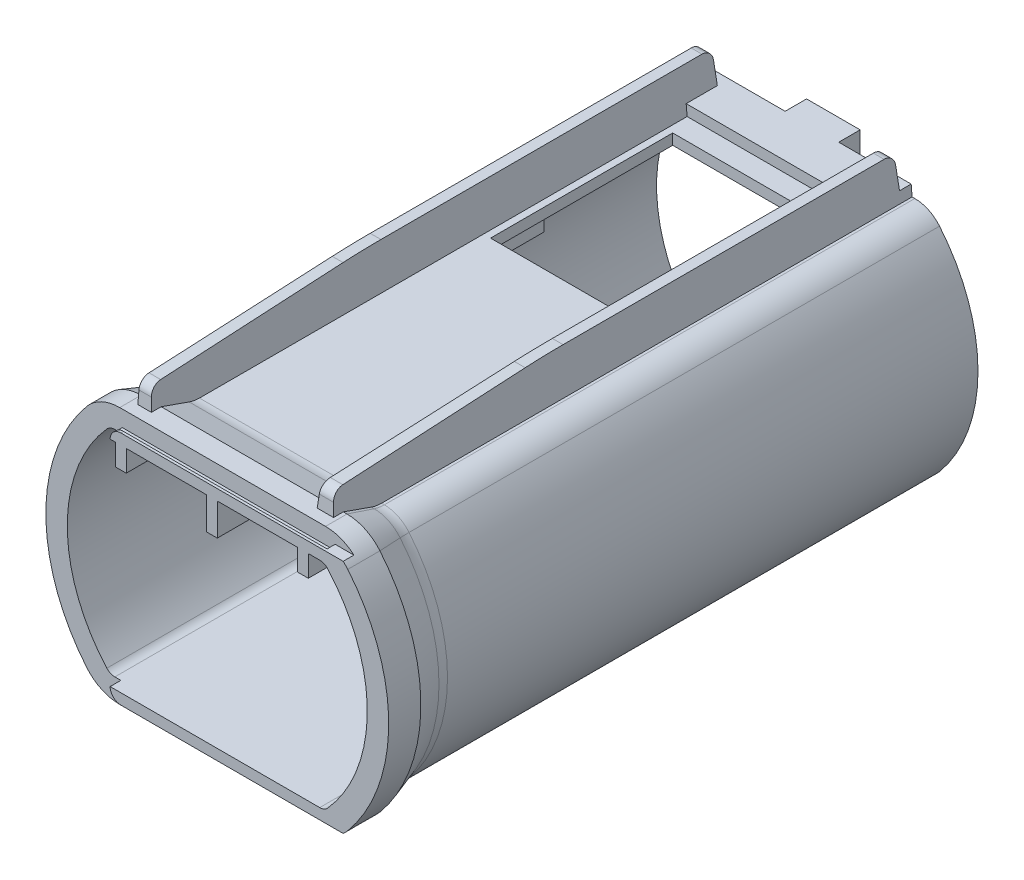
SolidWorks part; units mm, degrees
ref_plane "Front Plane" through (0, 0, 0) normal (0, 0, 1) x (1, 0, 0)
ref_plane "Top Plane" through (0, 0, 0) normal (0, 1, 0) x (1, 0, 0)
ref_plane "Right Plane" through (0, 0, 0) normal (1, 0, 0) x (0, 0, -1)
sketch "Sketch1" plane through (0, 0, 0) normal (0, 0, 1) x (1, 0, 0)
  line L0 (0, -10) -> (0, 10) construction
  line L1 (-10.5, 10) -> (10.5, 10)
  line L2 (14.5, 0) -> (14.5, 10) construction
  line L3 (-10.5, -10) -> (10.5, -10)
  line L4 (10.5, 10) -> (10.5, -10) construction
  line L5 (-14.5, 0) -> (-14.5, 15.1719) construction
  arc A0 (10.5, -10) -> (10.5, 10) centre (0, 0) ccw
  arc A1 (-10.5, 10) -> (-10.5, -10) centre (0, 0) ccw
  point P8 (0, 0)
  dimension "D1" = 29
  dimension "D2" = 20
extrude "Extrude-Thin2" add sketch "Sketch1" along normal blind 53 thin
fillet "Fillet3" radius 1 4 edges at (-10.5, -10, 26.5) (10.5, -10, 26.5) (10.5, 10, 26.5) (-10.5, 10, 26.5)
fillet "Fillet4" radius 3 4 edges at (-10.9202, 11, 26.5) (10.9202, 11, 26.5) (10.9202, -11, 26.5) (-10.9202, -11, 26.5)
ref_plane "Plane2" through (0, 0, 56) normal (0, 0, 1) x (1, 0, 0)
sketch "Sketch27" plane through (0, 0, 53) normal (0, 0, 1) x (1, 0, 0)
  circle A0 centre (0, 0) radius 21.9056
extrude "Extrude13" add sketch "Sketch27" along normal blind 2
chamfer "Chamfer1" distance 3 distance2 1 8 edges at (0, -11, 53) (10.8775, -10.7166, 53) (-10.8775, -10.7166, 53) (15.5, 0, 53) (-15.5, 0, 53) (10.8775, 10.7166, 53) (-10.8775, 10.7166, 53) (0, 11, 53)
ref_plane "Plane4" through (0, 0, 53) normal (0, 0, -1) x (-1, 0, 0)
other "SurfaceCut1"
fillet "Fillet6" radius 3 8 edges at (-10.8775, 10.7166, 50) (-10.8775, -10.7166, 50) (0, -11, 50) (10.8775, -10.7166, 50) (15.5, 0, 50) (10.8775, 10.7166, 50) (0, 11, 50) (-15.5, 0, 50)
sketch "Sketch8" plane through (0, 11, 0) normal (0, 1, 0) x (-1, 0, 0)
  line L1 (9, 0) -> (-9, 0)
  line L2 (9, 0) -> (9, 4)
  line L3 (9, 4) -> (-9, 4)
  line L4 (-9, 0) -> (-9, 4)
  line L5 (-9.6047, 0) -> (9.6047, 0) construction
  point P6 (0, 4)
  dimension "D1" = 18
  dimension "D2" = 4
extrude "Extrude7" add sketch "Sketch8" along normal blind 1
sketch "Sketch28" plane through (0, 0, 53) normal (0, 0, 1) x (1, 0, 0)
  line L0 (10.0623, 10) -> (-10.0623, 10) construction
  line L1 (-10.0623, -10) -> (10.0623, -10) construction
  line L2 (9.6047, 12) -> (-9.6047, 12)
  line L3 (9.6047, 12) -> (-9.6047, 12)
  line L4 (-9.6047, -12) -> (9.6047, -12)
  line L5 (-9.6047, -12) -> (9.6047, -12)
  line L6 (10.0623, 10) -> (-10.0623, 10)
  line L7 (-10.0623, -10) -> (10.0623, -10)
  arc A0 (10.0623, -10) -> (10.8077, -9.6667) centre (10.0623, -9) ccw construction
  arc A1 (10.8077, -9.6667) -> (10.8077, 9.6667) centre (0, 0) ccw construction
  arc A2 (10.8077, 9.6667) -> (10.0623, 10) centre (10.0623, 9) ccw construction
  arc A3 (-10.0623, 10) -> (-10.8077, 9.6667) centre (-10.0623, 9) ccw construction
  arc A4 (-10.8077, 9.6667) -> (-10.8077, -9.6667) centre (0, 0) ccw construction
  arc A5 (-10.8077, -9.6667) -> (-10.0623, -10) centre (-10.0623, -9) ccw construction
  arc A6 (10.0623, -10) -> (10.8077, -9.6667) centre (10.0623, -9) ccw
  arc A7 (10.8077, -9.6667) -> (10.8077, 9.6667) centre (0, 0) ccw
  arc A8 (12.6782, 10.56) -> (9.6047, 12) centre (9.6047, 8) ccw
  arc A9 (12.6782, 10.56) -> (9.6047, 12) centre (9.6047, 8) ccw
  arc A10 (-9.6047, 12) -> (-12.6782, 10.56) centre (-9.6047, 8) ccw
  arc A11 (-9.6047, 12) -> (-12.6782, 10.56) centre (-9.6047, 8) ccw
  arc A12 (-12.6782, -10.56) -> (-9.6047, -12) centre (-9.6047, -8) ccw
  arc A13 (-12.6782, -10.56) -> (-9.6047, -12) centre (-9.6047, -8) ccw
  arc A14 (-12.6782, 10.56) -> (-12.6782, -10.56) centre (0, 0) ccw
  arc A15 (-12.6782, 10.56) -> (-12.6782, -10.56) centre (0, 0) ccw
  arc A16 (9.6047, -12) -> (12.6782, -10.56) centre (9.6047, -8) ccw
  arc A17 (9.6047, -12) -> (12.6782, -10.56) centre (9.6047, -8) ccw
  arc A18 (12.6782, -10.56) -> (12.6782, 10.56) centre (0, 0) ccw
  arc A19 (12.6782, -10.56) -> (12.6782, 10.56) centre (0, 0) ccw
  arc A24 (10.8077, 9.6667) -> (10.0623, 10) centre (10.0623, 9) ccw
  arc A25 (-10.0623, 10) -> (-10.8077, 9.6667) centre (-10.0623, 9) ccw
  arc A26 (-10.8077, 9.6667) -> (-10.8077, -9.6667) centre (0, 0) ccw
  arc A27 (-10.8077, -9.6667) -> (-10.0623, -10) centre (-10.0623, -9) ccw
  dimension "D1" = 0
extrude "Extrude14" add sketch "Sketch28" along normal blind 3
sketch "Sketch9" plane through (9, 0, 0) normal (1, 0, 0) x (0, 0, -1)
  line L0 (-1, 11) -> (-1.35, 15)
  line L2 (-54, 11) -> (-53.7375, 14)
  line L3 (-53.7375, 14) -> (-35.7699, 14.9103)
  line L4 (-32.2279, 15) -> (-1.35, 15)
  line L5 (-54, 11) -> (-1, 11)
  line L6 (-1, 11) -> (-1, 22.6172) construction
  line L7 (-54, 11) -> (-54, 21.6834) construction
  arc A0 (-35.7699, 14.9103) -> (-32.2279, 15) centre (-32.2279, -55) cw
  point P15 (-34, 15)
  dimension "D8" = 70
  dimension "D1" = 5
  dimension "D2" = 5
  dimension "D3" = 4
  dimension "D7" = 3
extrude "Extrude8" add sketch "Sketch9" against normal blind 1
draft "Draft1" type of draft neutral plane draft angle 5 faces to draft 2 parameters "D1"=5
fillet "Fillet5" radius 1 2 edges at (8.5, 15, 1.35) (8.5, 14, 53.7375)
mirror "Mirror2" about plane through (0, 0, 0) normal (1, 0, 0) of "Fillet5", "Draft1", "Extrude8"
sketch "Sketch14" plane through (0, 0, 56) normal (0, 0, 1) x (1, 0, 0)
  line L12 (9.6047, 12) -> (-9.6047, 12) construction
  line L13 (-9.6047, -12) -> (9.6047, -12) construction
  line L16 (9.6047, 12) -> (-9.6047, 12)
  line L19 (-9.6047, -12) -> (9.6047, -12)
  line L20 (10.0623, 11) -> (-10.0623, 11)
  line L21 (12.2504, 11) -> (-8.5, 11)
  line L22 (-10.0623, 10) -> (-9.5, 10)
  line L23 (-10.0623, -11) -> (10.0623, -11)
  line L24 (-8.5, -11) -> (12.2504, -11)
  line L25 (10.0623, 10) -> (-10.0623, 10) construction
  line L26 (-10.0623, -10) -> (-9.5, -10)
  line L27 (-10.0623, -10) -> (10.0623, -10) construction
  line L28 (-9.5, -10) -> (-9.5, 10) construction
  arc A12 (-10.8077, -9.6667) -> (-10.0623, -10) centre (-10.0623, -9) ccw construction
  arc A13 (-10.8077, 9.6667) -> (-10.8077, -9.6667) centre (0, 0) ccw construction
  arc A14 (-10.0623, 10) -> (-10.8077, 9.6667) centre (-10.0623, 9) ccw construction
  arc A18 (12.6782, 10.56) -> (9.6047, 12) centre (9.6047, 8) ccw construction
  arc A19 (-9.6047, 12) -> (-12.6782, 10.56) centre (-9.6047, 8) ccw construction
  arc A20 (-12.6782, 10.56) -> (-12.6782, -10.56) centre (0, 0) ccw construction
  arc A21 (-12.6782, -10.56) -> (-9.6047, -12) centre (-9.6047, -8) ccw construction
  arc A22 (9.6047, -12) -> (12.6782, -10.56) centre (9.6047, -8) ccw construction
  arc A25 (-10.8077, -9.6667) -> (-10.0623, -10) centre (-10.0623, -9) ccw
  arc A26 (-10.8077, 9.6667) -> (-10.8077, -9.6667) centre (0, 0) ccw
  arc A27 (-10.0623, 10) -> (-10.8077, 9.6667) centre (-10.0623, 9) ccw
  arc A28 (12.2504, 11) -> (9.6047, 12) centre (9.6047, 8) ccw
  arc A29 (-9.6047, 12) -> (-12.6782, 10.56) centre (-9.6047, 8) ccw
  arc A30 (-12.6782, 10.56) -> (-12.6782, -10.56) centre (0, 0) ccw
  arc A31 (-12.6782, -10.56) -> (-9.6047, -12) centre (-9.6047, -8) ccw
  arc A32 (9.6047, -12) -> (12.2504, -11) centre (9.6047, -8) ccw
  arc A33 (-8.5, -11) -> (-9.5, -10) centre (-8.5, -10) cw
  arc A34 (-8.5, 11) -> (-9.5, 10) centre (-8.5, 10) ccw
  dimension "D3" = 7
  dimension "D1" = 1
  dimension "D2" = 1
extrude "Cut-Extrude3" cut sketch "Sketch14" against normal blind 1
sketch "Sketch15" plane through (0, -11, 0) normal (0, -1, 0) x (1, 0, 0)
  line L0 (-9.6047, 55) -> (9.6047, 55) construction
  line L1 (-9.5, 55) -> (10.5, 55)
  line L2 (-9.5, 55) -> (-9.5, 55.75)
  line L3 (-9.5, 55.75) -> (10.5, 55.75)
  line L4 (10.5, 55) -> (10.5, 55.75)
  line L8 (-9.5, 55) -> (-9.5, 56) construction
  dimension "D1" = 20
  dimension "D2" = 0.75
extrude "Cut-Extrude4" cut sketch "Sketch15" against normal blind 0.5
mirror "Mirror3" about plane through (0, 0, 0) normal (0, 1, 0) of "Cut-Extrude4"
sketch "Sketch16" plane through (0, 0, 56) normal (0, 0, 1) x (1, 0, 0)
  line L0 (8.5, 14.9103) -> (8.5, 4.0897) construction
  line L2 (-8.4961, 14.9103) -> (-8.4961, 3.833) construction
  line L7 (-8.4961, 10) -> (-8.4961, 8)
  line L9 (8.5, 8) -> (-8.4961, 8) construction
extrude "Extrude-Thin4" add sketch "Sketch16" against normal offset from surface (39 mm away) 17 thin
sketch "Sketch17" plane through (0, 0, 56) normal (0, 0, 1) x (1, 0, 0)
  line L0 (0, 0) -> (0, 10) construction
  line L2 (0, 10) -> (0, 7)
extrude "Extrude-Thin5" add sketch "Sketch17" against normal up to surface (39 mm away) thin
mirror "Mirror4" about plane through (0, 0, 0) normal (1, 0, 0) of "Extrude-Thin4"
sketch "Sketch18" plane through (0, 11, 0) normal (0, 1, 0) x (-1, 0, 0)
  line L0 (7.7375, 4) -> (-7.7375, 4) construction
  line L1 (-7.2461, 23) -> (6.9961, 23)
  line L4 (6.9961, 17) -> (6.9961, 56)
  line L5 (6.9961, 6) -> (6.9961, 23)
  line L6 (6.9961, 6) -> (-7.2461, 6)
  line L7 (-7.2461, 17) -> (-7.2461, 56)
  line L8 (-7.2461, 6) -> (-7.2461, 23)
  point P6 (-13.5092, 45.7766)
  dimension "D3" = 19
  dimension "D4" = 17
  dimension "D1" = 1
  dimension "D2" = 0.75
extrude "Cut-Extrude5" cut sketch "Sketch18" against normal up to surface (4 mm away)
sketch "Sketch20" plane through (0, 0, 0) normal (0, 0, -1) x (-1, 0, 0)
  line L3 (2.5, 12) -> (2.5, 10)
  line L4 (2.5, 10) -> (-2.5, 10)
  line L5 (-2.5, 12) -> (-2.5, 10)
  line L6 (0, 0) -> (0, 10) construction
  line L7 (-2.5, 12) -> (2.5, 12)
  line L8 (-9.2625, 12) -> (9, 12) construction
  line L9 (-10.0623, 10) -> (10.0623, 10) construction
  point P11 (0, 0)
  dimension "D1" = 5
extrude "Extrude9" add sketch "Sketch20" along normal blind 2
ref_plane "Plane3" through (-5.5, 0, 0) normal (1, 0, 0) x (0, 0, -1)
sketch "Sketch21" plane through (-5.5, 0, 0) normal (1, 0, 0) x (0, 0, -1)
  line L0 (-13, -11) -> (-13.1187, -13.2658)
  line L1 (-49.5132, -11) -> (0, -11) construction
  line L2 (-18.8813, -13.2658) -> (-19, -11)
  line L3 (-19, -11) -> (-13, -11)
  line L4 (-16, -13.1148) -> (-16, 4.3405) construction
  line L6 (0, -9.92) -> (0, 9.92) construction
  arc A0 (-13.1187, -13.2658) -> (-18.8813, -13.2658) centre (-16, -13.1148) cw
  dimension "D2" = 5
  dimension "D1" = 6
  dimension "D3" = 3
  dimension "D4" = 16
extrude "Extrude10" add sketch "Sketch21" along normal blind 1
sketch "Sketch22" plane through (-5.5, 0, 0) normal (-1, 0, 0) x (0, 0, 1)
  circle A0 centre (16, -13.1148) radius 1
  dimension "D1" = 2
extrude "Cut-Extrude6" cut sketch "Sketch22" against normal through all
mirror "Mirror5" about plane through (0, 0, 0) normal (1, 0, 0) of "Cut-Extrude6", "Extrude10"
sketch "Sketch24" plane through (-4.5, 0, 0) normal (1, 0, 0) x (0, 0, -1)
  line L0 (-13.1187, -13.2658) -> (-13, -11) construction
  line L1 (-13, -11) -> (-19, -11) construction
  line L2 (-13.1187, -13.2658) -> (-13, -11)
  line L3 (-13, -11) -> (-13.7375, -11)
  line L4 (-13.1187, -13.2658) -> (-13.6187, -13.2658)
  line L5 (-13.6187, -13.2658) -> (-13.7375, -11)
  line L6 (-13.3687, -13.2658) -> (-13.3687, -8.7697) construction
  dimension "D1" = 0.5
extrude "Extrude11" add sketch "Sketch24" along normal blind 4.5
sketch "Sketch26" plane through (-4.5, 0, 5.2625) normal (1, 0, 0) x (0, 0, -1)
  line L0 (-13.7375, -11) -> (-13.6187, -13.2658) construction
  line L2 (-13.1187, -13.2658) -> (-13, -11)
  line L3 (-13, -11) -> (-13.7375, -11)
  line L4 (-13.1187, -13.2658) -> (-13.6187, -13.2658)
  line L5 (-13.6187, -13.2658) -> (-13.7375, -11)
  line L6 (-13.3687, -13.2658) -> (-13.3687, -8.7697) construction
extrude "Extrude12" add sketch "Sketch26" along normal up to surface (9 mm away)
